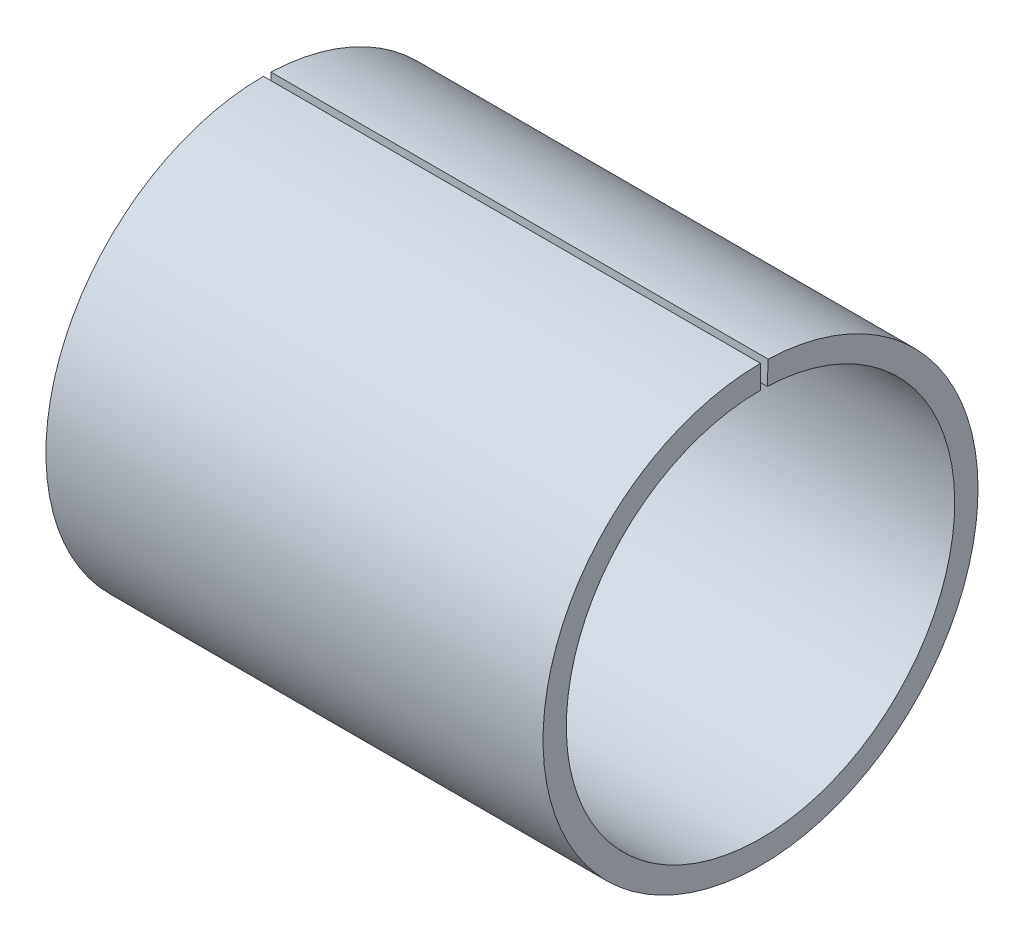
SolidWorks part; units mm, degrees
ref_plane "Plan1" through (0, 0, 0) normal (0, 0, 1) x (1, 0, 0)
ref_plane "Plan2" through (0, 0, 0) normal (0, 1, 0) x (1, 0, 0)
ref_plane "Plan3" through (0, 0, 0) normal (1, 0, 0) x (0, 0, -1)
sketch "Esquisse1" plane through (0, 0, 0) normal (0, 0, 1) x (1, 0, 0)
  line L0 (0, 0) -> (32, 0) construction
  line L1 (0, 14) -> (32, 14)
  line L2 (0, 14) -> (0, 12.5)
  line L3 (0, 12.5) -> (32, 12.5)
  line L4 (32, 14) -> (32, 12.5)
  dimension "D1" = 12.5
  dimension "D2" = 14
  dimension "D3" = 32
revolve "Base-Révolution" add sketch "Esquisse1" angle 358 about L0
